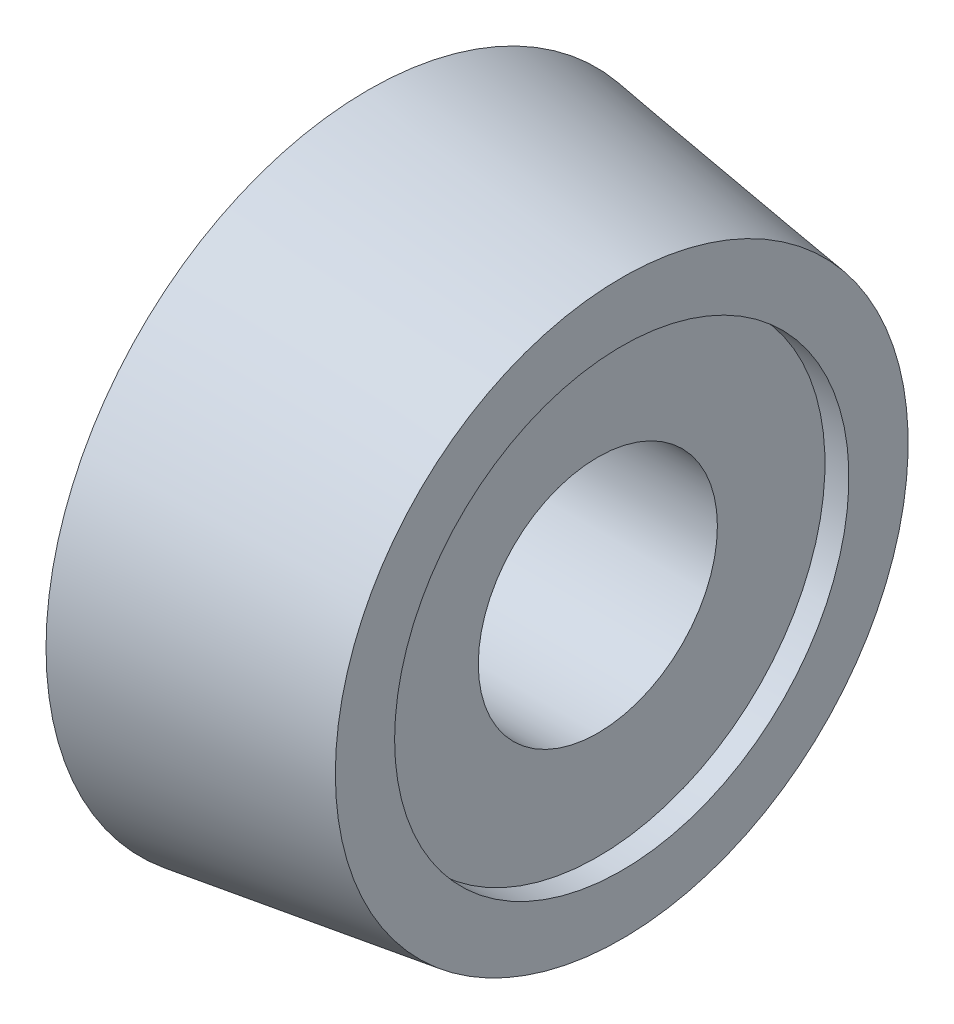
SolidWorks part; units mm, degrees
ref_plane "Přední rovina" through (0, 0, 0) normal (0, 0, 1) x (1, 0, 0)
ref_plane "Horní rovina" through (0, 0, 0) normal (0, 1, 0) x (1, 0, 0)
ref_plane "Pravá rovina" through (0, 0, 0) normal (1, 0, 0) x (0, 0, -1)
sketch "Skica1" plane through (0, 0, 0) normal (0, 0, 1) x (1, 0, 0)
  line L0 (-24.2501, 2.5) -> (-24.2501, 0.0107)
  line L1 (-18.4501, 6) -> (-18.4501, 4.7607)
  line L2 (-24.2501, 0.0107) -> (-18.9501, 0.0107)
  line L3 (-18.4501, 4.7607) -> (-18.9501, 4.7607)
  line L4 (-18.9501, 4.7607) -> (-18.9501, 0.0107)
  line L16 (-24.2501, 2.5) -> (-24.2501, 4.5)
  line L17 (-24.2501, 4.5) -> (-23.7501, 4.5)
  line L18 (-23.7501, 4.5) -> (-23.7501, 6.75)
  line L19 (-23.7501, 6.75) -> (-18.4501, 6)
  dimension "D2" = 4.75
  dimension "D3" = 5.3
  dimension "D4" = 5.9893
  dimension "D5" = 6.7393
  dimension "D6" = 4.4893
  dimension "D7" = 0.5
  dimension "D10" = 0.5
revolve "Rotovat1" add sketch "Skica1" angle 360 about L2
sketch "Skica2" plane through (-18.9501, 0, 0) normal (1, 0, 0) x (0, 0, -1)
  circle A0 centre (0, 0) radius 2.5
extrude "Odebrat vysunutím1" cut sketch "Skica2" against normal through all
sketch "Skica3" plane through (-24.2501, 0, 0) normal (-1, 0, 0) x (0, 0, 1)
  line L0 (3.9, 2.2342) -> (3.9, -2.2128)
  circle A0 centre (0, 0.0107) radius 4.4893 construction
  circle A1 centre (0, 0.0107) radius 4.4893 construction
  dimension "D1" = 3.9
extrude "Odebrat vysunutím2" cut sketch "Skica3" against normal up to surface (0.5 mm away) contours L0 M2
